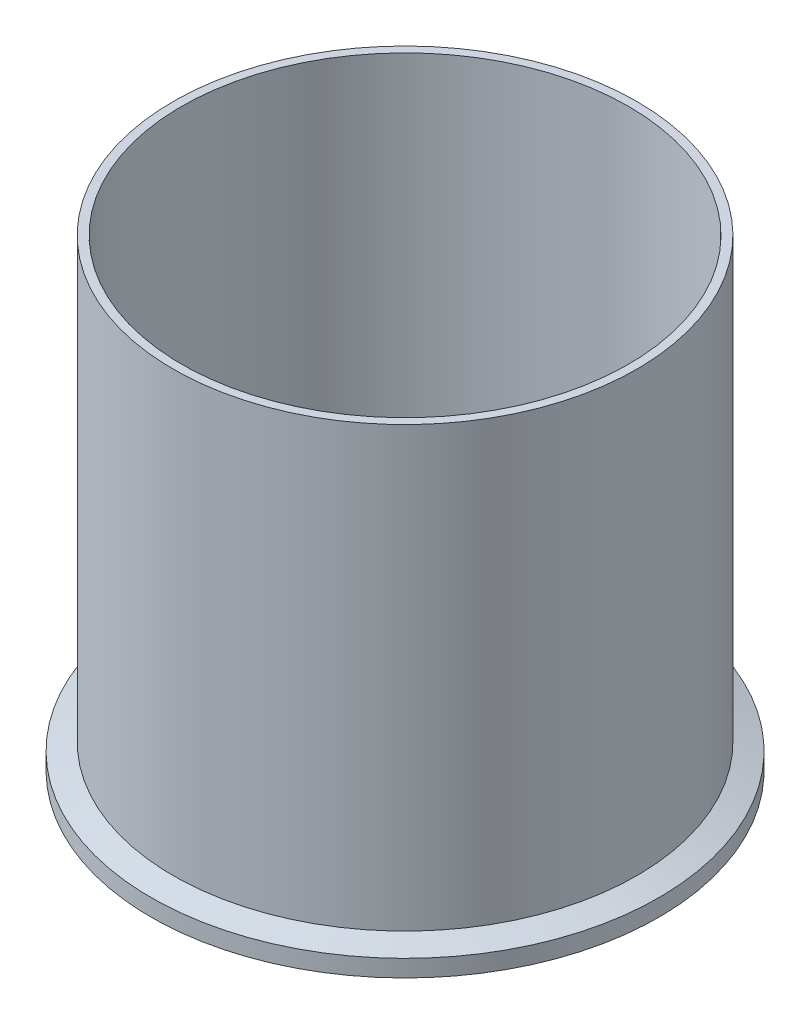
SolidWorks part; units mm, degrees
ref_plane "Front Plane" through (0, 0, 0) normal (0, 0, 1) x (1, 0, 0)
ref_plane "Top Plane" through (0, 0, 0) normal (0, 1, 0) x (1, 0, 0)
ref_plane "Right Plane" through (0, 0, 0) normal (1, 0, 0) x (0, 0, -1)
sketch "Sketch1" plane through (0, 0, 0) normal (0, 0, 1) x (1, 0, 0)
  line L0 (0, 0) -> (0, 152.4) construction
  line L1 (0, 152.4) -> (-76.2, 152.4)
  line L2 (-76.2, 152.4) -> (-76.2, 8.2228)
  line L3 (-76.2, 8.2228) -> (-83.439, 5.588)
  line L4 (-83.439, 5.588) -> (-83.439, 0)
  line L5 (-83.439, 0) -> (-79.9992, 0)
  line L6 (-76.3632, 0) -> (0, 0)
  line L7 (0, 0) -> (0, 152.4)
  line L8 (0, 152.4) -> (-73.4314, 152.4)
  line L9 (-73.4314, 152.4) -> (-73.4314, 0)
  line L10 (-73.4314, 0) -> (0, 0)
  line L11 (0, 0) -> (-0.1846, 0.0129)
  arc A0 (-79.2767, 0.4745) -> (-77.0857, 0.4745) centre (-78.1812, 0) cw
  arc A1 (-76.3632, 0) -> (-77.0857, 0.4745) centre (-76.3632, 0.7874) cw
  arc A2 (-79.2767, 0.4745) -> (-79.9992, 0) centre (-79.9992, 0.7874) cw
  point P12 (-76.9874, 0)
  dimension "D6" = 1.1938
  dimension "D7" = 0.7874
  dimension "3.00" = 76.2
  dimension "D2" = 5.588
  dimension "D3" = 83.439
  dimension "D4" = 70
  dimension "D5" = 78.1812
  dimension "D8" = 2.7686
  dimension "D9" = 152.4
revolve "Revolve2" add sketch "Sketch1" angle 360 about L0
